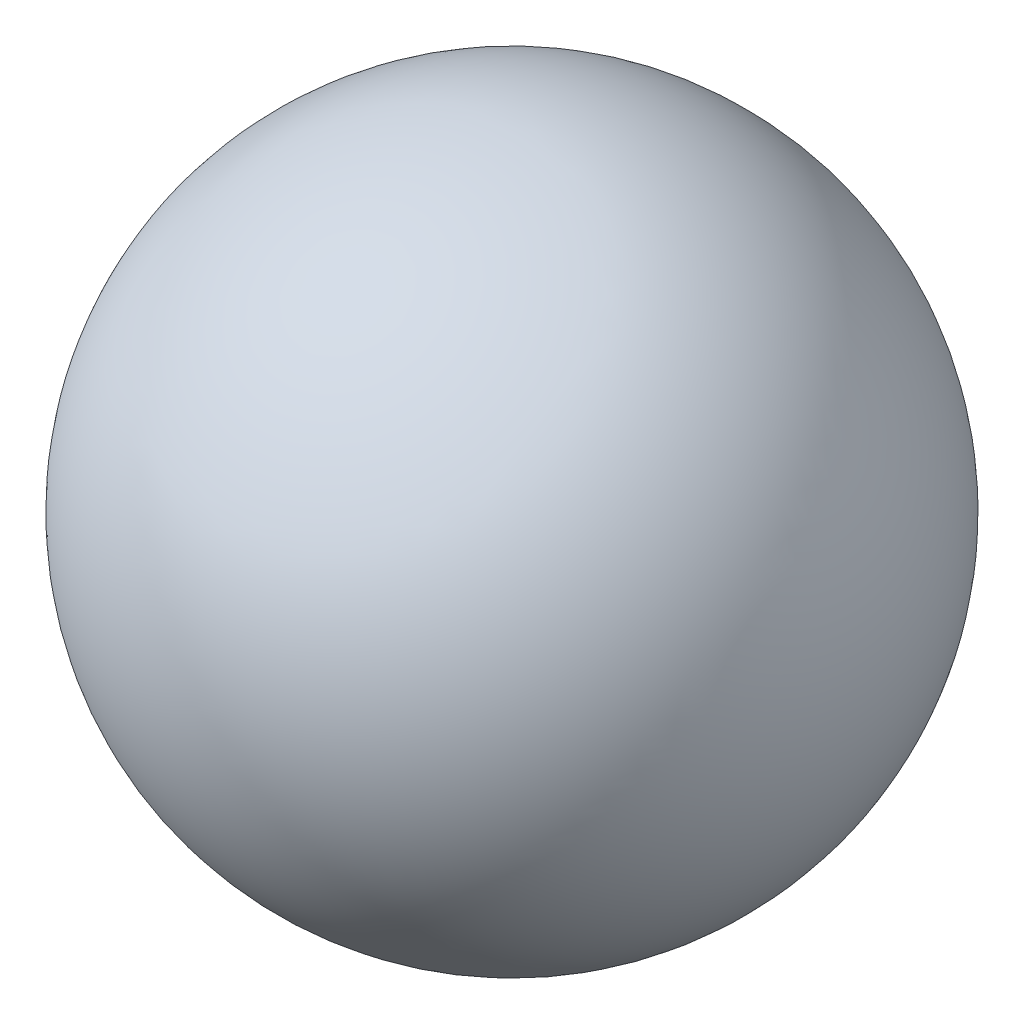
SolidWorks part; units mm, degrees
ref_plane "Front" through (0, 0, 0) normal (0, 0, 1) x (1, 0, 0)
ref_plane "Top" through (0, 0, 0) normal (0, 1, 0) x (1, 0, 0)
ref_plane "Right" through (0, 0, 0) normal (1, 0, 0) x (0, 0, -1)
sketch "Sketch1" plane through (0, 0, 0) normal (0, 0, 1) x (1, 0, 0)
  line L0 (-49.9329, 0) -> (54.7953, 0) construction
  line L1 (-75, 0) -> (75, 0)
  arc A0 (75, 0) -> (-75, 0) centre (0, 0) ccw
  dimension "D1" = 75
revolve "Revolve1" add sketch "Sketch1" angle 360 about L0
